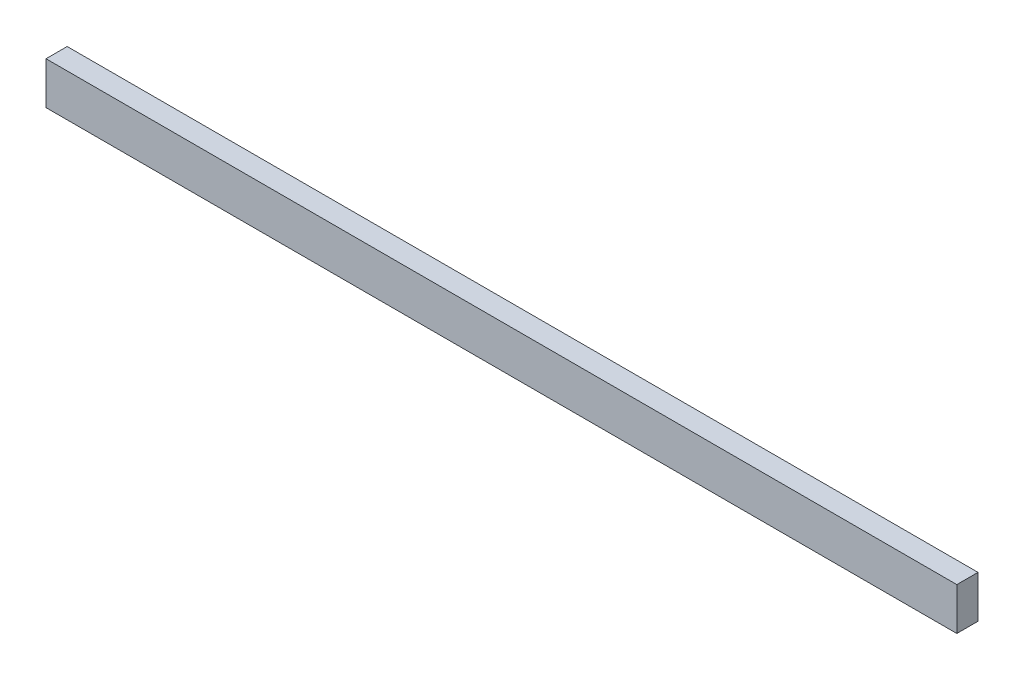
SolidWorks part; units mm, degrees
ref_plane "Front Plane" through (0, 0, 0) normal (0, 0, 1) x (1, 0, 0)
ref_plane "Top Plane" through (0, 0, 0) normal (0, 1, 0) x (1, 0, 0)
ref_plane "Right Plane" through (0, 0, 0) normal (1, 0, 0) x (0, 0, -1)
sketch "Sketch1" plane through (0, 0, 0) normal (0, 0, 1) x (1, 0, 0)
  line L1 (0, 0) -> (409.575, 0)
  line L2 (0, 0) -> (0, 19.05)
  line L3 (0, 19.05) -> (409.575, 19.05)
  line L4 (409.575, 0) -> (409.575, 19.05)
extrude "Boss-Extrude1" add sketch "Sketch1" along normal blind 9.525 contours L2 L3 L4 L1
